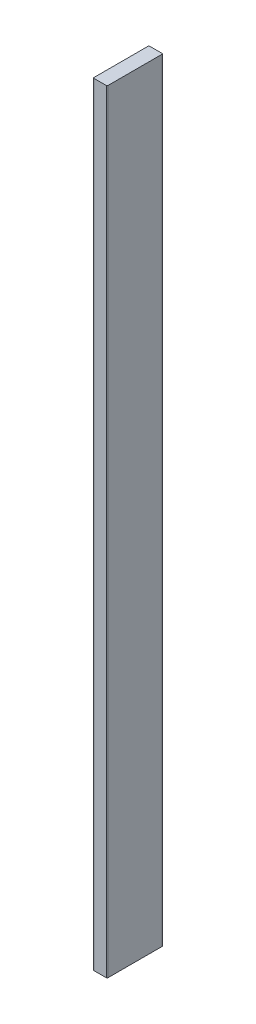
SolidWorks part; units mm, degrees
ref_plane "Plan de face" through (0, 0, 0) normal (0, 0, 1) x (1, 0, 0)
ref_plane "Plan de dessus" through (0, 0, 0) normal (0, 1, 0) x (1, 0, 0)
ref_plane "Plan de droite" through (0, 0, 0) normal (1, 0, 0) x (0, 0, -1)
ref_plane "Plan1" through (0, 277.5, 0) normal (0, 1, 0) x (1, 0, 0)
sketch "Esquisse1" plane through (0, 277.5, 0) normal (0, 1, 0) x (1, 0, 0)
  line L0 (-4.5, -20) -> (4.5, -20)
  line L1 (5, -19.5) -> (5, 19.5)
  line L2 (4.5, 20) -> (-4.5, 20)
  line L3 (-5, 19.5) -> (-5, -19.5)
  arc A0 (4.5, -20) -> (5, -19.5) centre (4.5, -19.5) ccw
  arc A1 (5, 19.5) -> (4.5, 20) centre (4.5, 19.5) ccw
  arc A2 (-4.5, 20) -> (-5, 19.5) centre (-4.5, 19.5) ccw
  arc A3 (-5, -19.5) -> (-4.5, -20) centre (-4.5, -19.5) ccw
extrude "Boss.-Extru.1" add sketch "Esquisse1" against normal blind 555
